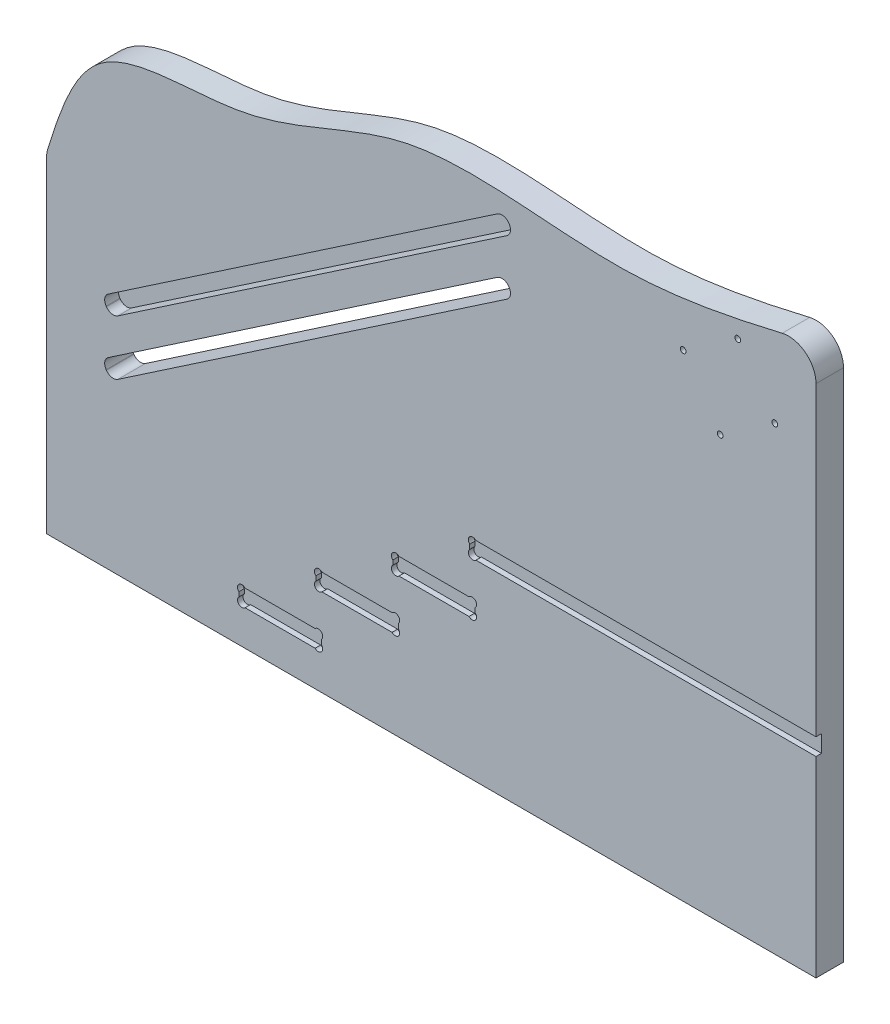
SolidWorks part; units mm, degrees
ref_plane "Plan de face" through (0, 0, 0) normal (0, 0, 1) x (1, 0, 0)
ref_plane "Plan de dessus" through (0, 0, 0) normal (0, 1, 0) x (1, 0, 0)
ref_plane "Plan de droite" through (0, 0, 0) normal (1, 0, 0) x (0, 0, -1)
sketch "Esquisse1" plane through (0, 0, 0) normal (0, 0, 1) x (1, 0, 0)
  line L0 (-80, 71.6786) -> (-80, -48.3214)
  line L1 (-80, -48.3214) -> (200, -48.3214)
  line L2 (200, -48.3214) -> (200, 151.6786)
  spline S0 degree 3 poles (-80, 71.6786) (-75.2015, 87.0661) (-64.7427, 120.6047) (-2.7646, 114.4015) (53.1066, 150.4074) (127.8629, 134.1039) (176.9329, 146.0588) (200, 151.6786) knots 0 0 0 0 0.14015 0.305472 0.510529 0.769907 1 1 1 1
  dimension "D1" = 280
  dimension "D2" = 120
  dimension "D3" = 200
extrude "Extrusion1" add sketch "Esquisse1" along normal blind 10
fillet "Congé1" radius 10 4 edges at (200, 151.6786, 5) (-80, 71.6786, 5)
sketch "Esquisse2" plane through (0, 0, 10) normal (0, 0, 1) x (1, 0, 0)
  line L1 (-10, -29.3214) -> (20, -29.3214)
  line L2 (-10, -29.3214) -> (-10, -35.5214)
  line L3 (-10, -35.5214) -> (20, -35.5214)
  line L4 (20, -29.3214) -> (20, -35.5214)
  line L5 (18, -10.3214) -> (48, -10.3214)
  line L6 (18, -10.3214) -> (18, -16.5214)
  line L7 (18, -16.5214) -> (48, -16.5214)
  line L8 (48, -10.3214) -> (48, -16.5214)
  line L9 (46, 8.6786) -> (76, 8.6786)
  line L10 (46, 8.6786) -> (46, 2.4786)
  line L11 (46, 2.4786) -> (76, 2.4786)
  line L12 (76, 8.6786) -> (76, 2.4786)
  line L13 (-80, -48.3214) -> (200, -48.3214) construction
  line L15 (200, 21.4786) -> (74, 21.4786)
  line L16 (200, 21.4786) -> (200, 27.6786)
  line L17 (200, 27.6786) -> (74, 27.6786)
  line L18 (74, 21.4786) -> (74, 27.6786)
  dimension "D1" = 6.2
  dimension "D2" = 6.2
  dimension "D3" = 6.2
  dimension "D4" = 30
  dimension "D5" = 30
  dimension "D6" = 30
  dimension "D7" = 19
  dimension "D8" = 19
  dimension "D9" = 19
  dimension "D10" = 28
  dimension "D11" = 28
  dimension "D12" = 6.2
  dimension "D13" = 28
  dimension "D14" = 19
  dimension "D15" = 126
extrude "Enlèv. mat.-Extru.1" cut sketch "Esquisse2" against normal blind 2
sketch "Esquisse3" plane through (0, 0, 10) normal (0, 0, 1) x (1, 0, 0)
  line L0 (-56.5187, 11.6221) -> (90, 111.0455)
  line L1 (90, 111.0455) -> (86.5187, 116.1758)
  line L2 (-56.5187, 11.6221) -> (-60, 16.7524)
  line L3 (-60, 16.7524) -> (86.5187, 116.1758)
  line L7 (-80, 70.1548) -> (-80, -48.3214) construction
  line L8 (200, -48.3214) -> (200, 21.4786) construction
  line L9 (-80, -48.3214) -> (200, -48.3214) construction
  dimension "D1" = 90
  dimension "D2" = 90
  dimension "D3" = 90
  dimension "D4" = 60
  dimension "D5" = 60
  dimension "D6" = 6.2
  dimension "D7" = 20
  dimension "D8" = 110
  dimension "D9" = 34.16
extrude "Enlèv. mat.-Extru.2" cut sketch "Esquisse3" against normal blind 10
sketch "Esquisse4" plane through (0, 0, 10) normal (0, 0, 1) x (1, 0, 0)
  line L0 (-56.5187, 31.6347) -> (90, 131.0581)
  line L1 (90, 131.0581) -> (86.5187, 136.1885)
  line L2 (86.5187, 136.1885) -> (-60, 36.7651)
  line L3 (-60, 36.7651) -> (-56.5187, 31.6347)
  line L6 (-80, 70.1548) -> (-80, -48.3214) construction
  line L7 (200, -48.3214) -> (200, 21.4786) construction
  dimension "D1" = 6.2
  dimension "D2" = 76.56
  dimension "D3" = 20
  dimension "D4" = 110
  dimension "D5" = 76.56
extrude "Enlèv. mat.-Extru.3" cut sketch "Esquisse4" against normal blind 5
fillet "Congé2" radius 3 8 edges at (-56.5187, 11.6221, 5) (-60, 16.7524, 5) (86.5187, 116.1758, 5) (90, 111.0455, 5) (-56.5187, 31.6347, 7.5) (-60, 36.7651, 7.5) (86.5187, 136.1885, 7.5) (90, 131.0581, 7.5)
sketch "Esquisse5" plane through (0, 0, 10) normal (0, 0, 1) x (1, 0, 0)
  line L0 (200, -48.3214) -> (200, 21.4786) construction
  line L1 (185, 118.9802) -> (-25.6098, -23.9352) construction
  line L2 (-80, -48.3214) -> (200, -48.3214) construction
  line L3 (185, 118.9802) -> (162.6296, 151.9468) construction
  circle A0 centre (151.6645, 125.3635) radius 1.05
  circle A1 centre (171.5239, 138.8396) radius 1.05
  circle A2 centre (165.1407, 105.5041) radius 1.05
  circle A3 centre (185, 118.9802) radius 1.05
  dimension "D1" = 2.1
  dimension "D2" = 2.1
  dimension "D3" = 2.1
  dimension "D4" = 2.1
  dimension "D5" = 24
  dimension "D6" = 24
  dimension "D7" = 24
  dimension "D8" = 24
  dimension "D9" = 15
  dimension "D10" = 20
  dimension "D11" = 34.16
  dimension "D12" = 90
extrude "Enlèv. mat.-Extru.4" cut sketch "Esquisse5" against normal blind 10
sketch "Esquisse6" plane through (0, 0, 10) normal (0, 0, 1) x (1, 0, 0)
  line L0 (-10, -29.3214) -> (-10, -35.5214) construction
  line L1 (20, -29.3214) -> (-10, -29.3214) construction
  line L2 (-10, -35.5214) -> (20, -35.5214) construction
  line L3 (5, -20) -> (5, -40) construction
  line L4 (20, -35.5214) -> (20, -29.3214) construction
  line L5 (18, -10.3214) -> (18, -16.5214) construction
  line L6 (18, -16.5214) -> (48, -16.5214) construction
  line L7 (48, -10.3214) -> (18, -10.3214) construction
  line L8 (33, 0) -> (33, -20) construction
  line L9 (48, -16.5214) -> (48, -10.3214) construction
  line L10 (46, 8.6786) -> (46, 2.4786) construction
  line L11 (46, 2.4786) -> (76, 2.4786) construction
  line L12 (76, 8.6786) -> (46, 8.6786) construction
  line L13 (61, 10) -> (61, 0) construction
  line L14 (76, 2.4786) -> (76, 8.6786) construction
  line L15 (74, 27.6786) -> (74, 21.4786) construction
  line L16 (74, 21.4786) -> (200, 21.4786) construction
  line L17 (200, 27.6786) -> (74, 27.6786) construction
  circle A0 centre (-8.9, -30.4214) radius 1.6
  circle A1 centre (-8.9, -34.4214) radius 1.6
  circle A2 centre (18.9, -34.4214) radius 1.6
  circle A3 centre (18.9, -30.4214) radius 1.6
  circle A4 centre (19.1, -11.4214) radius 1.6
  circle A5 centre (19.1, -15.4214) radius 1.6
  circle A6 centre (46.9, -15.4214) radius 1.6
  circle A7 centre (46.9, -11.4214) radius 1.6
  circle A8 centre (47.1, 7.5786) radius 1.6
  circle A9 centre (47.1, 3.5786) radius 1.6
  circle A10 centre (74.9, 3.5786) radius 1.6
  circle A11 centre (74.9, 7.5786) radius 1.6
  circle A12 centre (75.1, 26.5786) radius 1.6
  circle A13 centre (75.1, 22.5786) radius 1.6
  dimension "D1" = 1.1
  dimension "D6" = 1.1
  dimension "D11" = 1.1
  dimension "D16" = 1.1
  dimension "D2" = 1.1
  dimension "D3" = 1.1
  dimension "D4" = 1.1
  dimension "D5" = 15
  dimension "D7" = 1.1
  dimension "D8" = 1.1
  dimension "D9" = 1.1
  dimension "D10" = 15
  dimension "D12" = 1.1
  dimension "D13" = 1.1
  dimension "D14" = 1.1
  dimension "D15" = 15
  dimension "D17" = 1.1
  dimension "D18" = 1.1
  dimension "D19" = 1.1
extrude "Enlèv. mat.-Extru.5" cut sketch "Esquisse6" against normal blind 2
